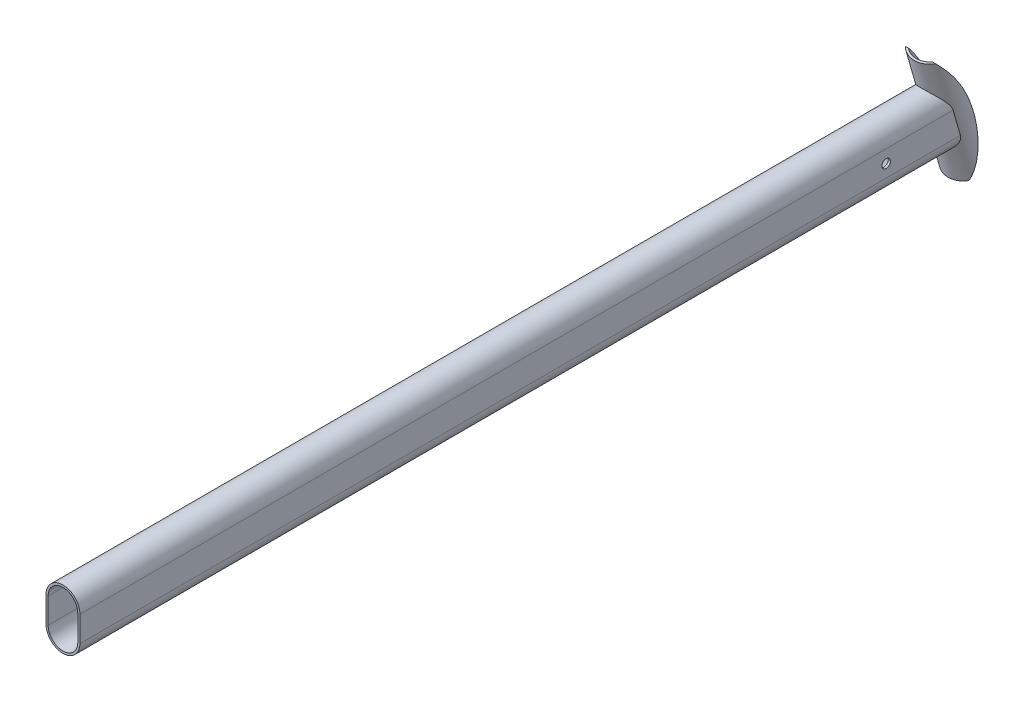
SolidWorks part; units mm, degrees
ref_plane "Plan de face" through (0, 0, 0) normal (0, 0, 1) x (1, 0, 0)
ref_plane "Plan de dessus" through (0, 0, 0) normal (0, 1, 0) x (1, 0, 0)
ref_plane "Plan de droite" through (0, 0, 0) normal (1, 0, 0) x (0, 0, -1)
sketch "Esquisse1" plane through (0, 0, 0) normal (0, 0, 1) x (1, 0, 0)
  line L2 (0, 0) -> (0, 30)
  line L4 (40, 0) -> (40, 30)
  arc A0 (40, 30) -> (0, 30) centre (20, 30) ccw
  arc A1 (0, 0) -> (40, 0) centre (20, 0) ccw
  dimension "D1" = 40
  dimension "D2" = 30
extrude "Extru.-Mince1" add sketch "Esquisse1" along normal blind 1060 thin
ref_plane "Plan1" through (0, -20, 0) normal (0, 1, 0) x (-1, 0, 0)
sketch "Esquisse2" plane through (0, -20, 0) normal (0, 1, 0) x (-1, 0, 0)
  line L0 (0, 0) -> (-41.1869, 0) construction
ref_plane "Plan2" through (0, -18.4805, -5.2992) normal (0, 0.9613, 0.2756) x (-1, 0, 0)
sketch "Esquisse3" plane through (0, -18.4805, -5.2992) normal (0, 0.9613, 0.2756) x (-1, 0, 0)
  line L1 (-20, 35.3251) -> (-20, -26.1357) construction
  line L2 (0, 1010.6683) -> (0, -8.2691) construction
  line L3 (-42.5, 5.5127) -> (-42.5, -16.9873)
  line L4 (-42.5, -16.9873) -> (2.5, -16.9873)
  line L5 (2.5, 5.5127) -> (2.5, -16.9873)
  line L6 (-40, 1010.6683) -> (-40, -8.2691) construction
  line L7 (0, 5.5127) -> (-41.1869, 5.5127) construction
  arc A0 (2.5, 5.5127) -> (-42.5, 5.5127) centre (-20, 5.5127) ccw
  point P11 (-20, 5.5127)
  dimension "D1" = 45
extrude "Enlèv. mat.-Extru.4" cut sketch "Esquisse3" along normal through all
sketch "Esquisse5" plane through (0, -18.4805, -5.2992) normal (0, 0.9613, 0.2756) x (-1, 0, 0)
  circle A0 centre (-20, 5.5127) radius 22.5
  arc A1 (0, 15.8205) -> (-40, 15.8205) centre (-20, 5.5127) ccw construction
extrude "Extru.-Mince2" add sketch "Esquisse5" along normal blind 115 and the other way blind 30 separate body thin
sketch "Esquisse6" plane through (0, 0, 0) normal (1, 0, 0) x (0, 0, -1)
  line L0 (27.5, -20) -> (-27.5, -20) construction
  line L1 (-10.0699, 96.7469) -> (-53.3267, 84.3433) construction
  line L3 (-15.7624, -55.7288) -> (32.3007, -41.9469) construction
  line L4 (-7.6668, 97.436) -> (-48.575, 85.7058)
  line L5 (32.3007, -41.9469) -> (-7.6668, 97.436)
  line L6 (-8.8451, -53.7453) -> (32.3007, -41.9469)
  line L7 (32.3007, -41.9469) -> (-7.6668, 97.436) construction
  arc A0 (-8.8451, -53.7453) -> (-48.575, 85.7058) centre (-155, -20) ccw
  dimension "D1" = 300
  dimension "D2" = 155
extrude "Enlèv. mat.-Extru.6" cut sketch "Esquisse6" against normal through all and the other way through all
sketch "Esquisse7" plane through (0, 0, 0) normal (1, 0, 0) x (0, 0, -1)
  line L0 (-321.0019, 15) -> (100.0422, 15) construction
  line L1 (-1060, 30) -> (-25.0604, 30) construction
  line L2 (-1060, 0) -> (-16.4581, 0) construction
  line L3 (8.2691, -48.8379) -> (-31.6983, 90.5451) construction
  circle A0 centre (-108.8645, 15) radius 5
  dimension "D1" = 10
  dimension "D2" = 95
extrude "Enlèv. mat.-Extru.7" cut sketch "Esquisse7" against normal through all and the other way through all
